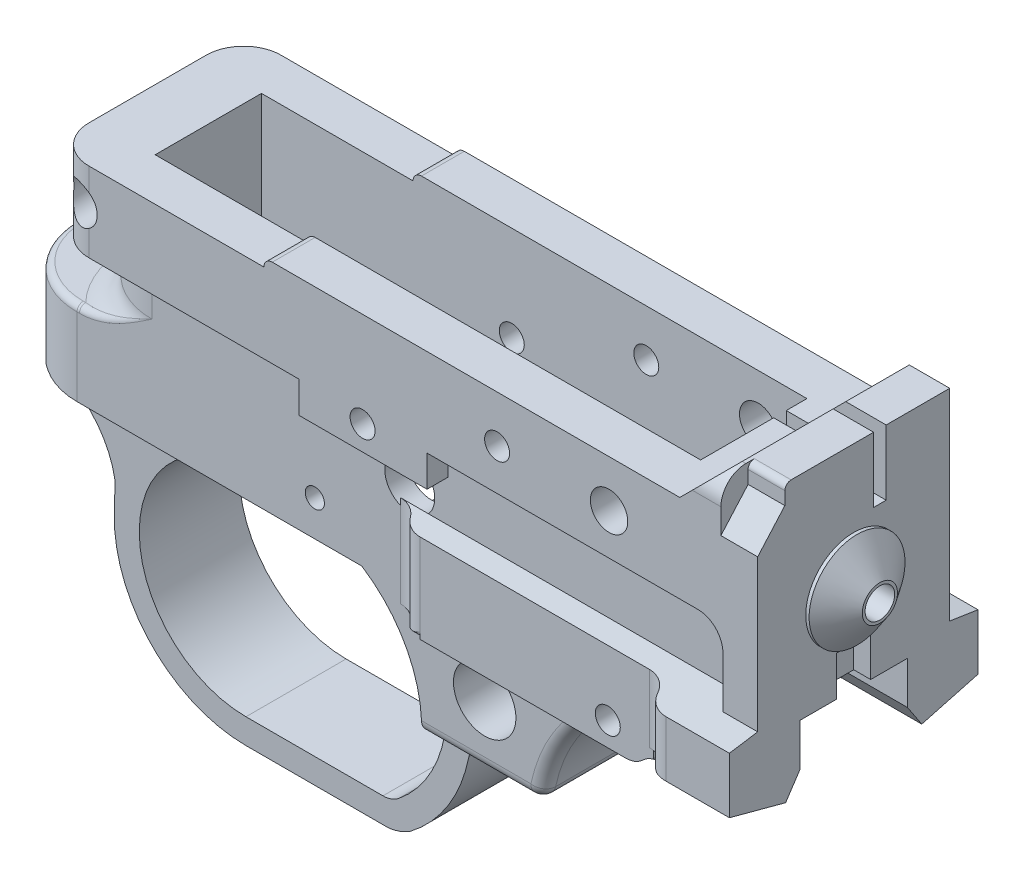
SolidWorks part; units mm, degrees
ref_plane "Front Plane" through (0, 0, 0) normal (0, 0, 1) x (1, 0, 0)
ref_plane "Top Plane" through (0, 0, 0) normal (0, 1, 0) x (1, 0, 0)
ref_plane "Right Plane" through (0, 0, 0) normal (1, 0, 0) x (0, 0, -1)
imported_body "Imported3"
sketch "Sketch1" plane through (0, 18.4153, 0) normal (0, 1, 0) x (-1, 0, 0)
  line L0 (26.5707, -18.3769) -> (26.5707, -21.0439)
  line L1 (26.5707, -21.0439) -> (26.5726, -21.0439)
  line L2 (26.5726, -21.0439) -> (26.5726, -18.3769)
  spline S0 degree 3 poles (26.5726, -18.3769) (26.5719, -18.3769) (26.5713, -18.3769) (26.5707, -18.3769) knots 0 0 0 0 1 1 1 1
extrude "Cut-Extrude1" cut sketch "Sketch1" against normal blind 15.5194
sketch "Sketch2" plane through (0, 0, -21.0439) normal (0, 0, -1) x (-1, 0, 0)
  line L0 (-47.1003, -12.382) -> (-47.1003, -12.6489)
  line L1 (-47.1003, -12.6489) -> (-45.8262, -12.6489)
  arc A0 (-45.8262, -12.6489) -> (-47.1003, -12.382) centre (-45.8262, -9.4739) cw
extrude "Cut-Extrude2" cut sketch "Sketch2" against normal blind 6.1722
sketch "Sketch3" plane through (47.1003, 0, 0) normal (1, 0, 0) x (0, 0, -1)
  line L0 (14.8717, -8.2039) -> (2.8067, -8.2039)
  line L1 (2.8067, -8.2039) -> (2.8067, -12.6489)
  line L2 (2.8067, -12.6489) -> (14.8717, -12.6489)
  line L3 (14.8717, -12.6489) -> (14.8717, -8.2039)
extrude "Cut-Extrude3" cut sketch "Sketch3" against normal blind 1.274
sketch "Sketch4" plane through (-26.5726, 0, 0) normal (-1, 0, 0) x (0, 0, 1)
  line L0 (-18.3769, -10.9471) -> (-18.3769, 2.8959)
  line L1 (-18.3769, 2.8959) -> (-21.0439, 2.8959)
  line L2 (-21.0439, 2.8959) -> (-21.0439, -10.9471)
  line L3 (-21.0439, -10.9471) -> (-18.3769, -10.9471)
extrude "Cut-Extrude4" cut sketch "Sketch4" against normal blind 9.527
sketch "Sketch5" plane through (45.8262, 0, 0) normal (1, 0, 0) x (0, 0, -1)
  line L0 (14.8717, -8.2039) -> (2.8067, -8.2039)
  line L1 (2.8067, -8.2039) -> (2.8067, -12.6489)
  line L2 (2.8067, -12.6489) -> (14.8717, -12.6489)
  line L3 (14.8717, -12.6489) -> (14.8717, -8.2039)
extrude "Cut-Extrude5" cut sketch "Sketch5" against normal blind 5.9505
sketch "Sketch6" plane through (-17.0457, 0, 0) normal (-1, 0, 0) x (0, 0, 1)
  line L0 (-18.3769, -10.9471) -> (-18.3769, 2.8959)
  line L1 (-18.3769, 2.8959) -> (-21.0439, 2.8959)
  line L2 (-21.0439, 2.8959) -> (-21.0439, -10.9471)
  line L3 (-21.0439, -10.9471) -> (-18.3769, -10.9471)
extrude "Cut-Extrude6" cut sketch "Sketch6" against normal blind 21.3487
sketch "Sketch7" plane through (58.1892, 0, 0) normal (1, 0, 0) x (0, 0, -1)
  line L0 (15.6718, -8.2039) -> (2.0066, -8.2039)
  line L1 (2.0066, -8.2039) -> (0.1905, -10.9471)
  line L2 (0.1905, -10.9471) -> (-6.9596, -9.0312)
  line L3 (-6.9596, -9.0312) -> (-6.9596, 19.4821)
  line L4 (-6.9596, 19.4821) -> (21.0439, 19.4821)
  line L5 (21.0439, 19.4821) -> (21.0439, 5.1311)
  line L6 (21.0439, 5.1311) -> (24.638, 5.1311)
  line L7 (24.638, 5.1311) -> (24.638, -9.0312)
  line L8 (24.638, -9.0312) -> (17.4879, -10.9471)
  line L9 (17.4879, -10.9471) -> (15.6718, -8.2039)
extrude "Boss-Extrude1" add sketch "Sketch7" along normal blind 0.7937
sketch "Sketch8" plane through (19.7149, 0, 0) normal (-1, 0, 0) x (0, 0, 1)
  line L0 (3.3655, -12.6489) -> (2.5718, -12.6489)
  line L1 (3.3655, -11.8551) -> (3.3655, -12.6489)
  arc A0 (2.5718, -12.6489) -> (3.3655, -11.8551) centre (2.5718, -11.8551) ccw
extrude "Boss-Extrude2" add sketch "Sketch8" along normal blind 2.1001
sketch "Sketch9" plane through (58.9829, 0, 0) normal (1, 0, 0) x (0, 0, -1)
  line L0 (15.6718, -8.2039) -> (2.0066, -8.2039)
  line L1 (2.0066, -8.2039) -> (0.1905, -10.9471)
  line L2 (0.1905, -10.9471) -> (-6.9596, -9.0312)
  line L3 (-6.9596, -9.0312) -> (-6.9596, 19.4821)
  line L4 (-6.9596, 19.4821) -> (21.0439, 19.4821)
  line L5 (21.0439, 19.4821) -> (21.0439, 5.1311)
  line L6 (21.0439, 5.1311) -> (24.638, 5.1311)
  line L7 (24.638, 5.1311) -> (24.638, -9.0312)
  line L8 (24.638, -9.0312) -> (17.4879, -10.9471)
  line L9 (17.4879, -10.9471) -> (15.6718, -8.2039)
extrude "Boss-Extrude3" add sketch "Sketch9" along normal blind 3.6258
sketch "Sketch10" plane through (17.6148, 0, 0) normal (-1, 0, 0) x (0, 0, 1)
  line L0 (2.5718, -12.6489) -> (3.3655, -12.6489)
  line L1 (3.3655, -12.6489) -> (3.3655, -11.8551)
  arc A0 (3.3655, -11.8551) -> (2.5718, -12.6489) centre (2.5718, -11.8551) cw
extrude "Cut-Extrude7" cut sketch "Sketch10" against normal blind 2.1001
sketch "Sketch11" plane through (49.5938, 0, 0) normal (1, 0, 0) x (0, 0, -1)
  line L0 (-3.3655, -9.9942) -> (-3.3655, -10.9471)
  line L1 (-3.3655, -10.9471) -> (0.1905, -10.9471)
  line L2 (0.1905, -10.9471) -> (-3.3655, -9.9942)
extrude "Cut-Extrude8" cut sketch "Sketch11" against normal blind 0.2058
sketch "Sketch12" plane through (0, 2.8959, 0) normal (0, -1, 0) x (1, 0, 0)
  line L0 (19.7149, 3.3655) -> (-26.5707, 3.3655)
  line L1 (-26.5707, 3.3655) -> (-26.5707, -8.8265)
  line L2 (-17.0457, 0.6985) -> (4.303, 0.6985)
  arc A0 (14.5421, 0.6985) -> (17.1285, 2.032) centre (14.5421, 3.8735) ccw
  arc A1 (17.1285, 2.032) -> (19.7149, 3.3655) centre (19.7149, 0.1905) cw
  arc A2 (-26.5707, -8.8265) -> (-17.0457, 0.6985) centre (-17.0457, -8.8265) cw
  spline S0 degree 1 poles (4.303, 0.6985) (14.5421, 0.6985) knots -2.347258 -2.347258 -0.242243 -0.242243
extrude "Cut-Extrude9" cut sketch "Sketch12" against normal blind 1.4224
sketch "Sketch13" plane through (0, -8.2039, 0) normal (0, -1, 0) x (1, 0, 0)
  line L0 (51.4953, -15.6718) -> (62.6087, -15.6718)
  line L1 (62.6087, -15.6718) -> (62.6087, -2.0066)
  line L2 (62.6087, -2.0066) -> (51.4953, -2.0066)
  line L3 (49.388, -2.8067) -> (39.8757, -2.8067)
  line L4 (39.8757, -2.8067) -> (39.8757, -14.8717)
  line L5 (39.8757, -14.8717) -> (49.388, -14.8717)
  arc A0 (51.4953, -2.0066) -> (50.4417, -2.4066) centre (51.4953, -3.5941) ccw
  arc A1 (50.4417, -2.4066) -> (49.388, -2.8067) centre (49.388, -1.2192) cw
  arc A2 (49.388, -14.8717) -> (50.4417, -15.2718) centre (49.388, -16.4592) cw
  arc A3 (50.4417, -15.2718) -> (51.4953, -15.6718) centre (51.4953, -14.0843) ccw
extrude "Cut-Extrude10" cut sketch "Sketch13" against normal blind 0.6043
sketch "Sketch14" plane through (0, 4.3183, 0) normal (0, -1, 0) x (1, 0, 0)
  line L0 (4.303, 3.3655) -> (-26.5707, 3.3655)
  line L1 (-26.5707, 3.3655) -> (-26.5707, -8.8265)
  line L2 (-17.0457, 0.6985) -> (4.303, 0.6985)
  line L3 (4.303, 0.6985) -> (4.303, 3.3655)
  arc A0 (-26.5707, -8.8265) -> (-17.0457, 0.6985) centre (-17.0457, -8.8265) cw
extrude "Cut-Extrude11" cut sketch "Sketch14" against normal blind 3.9878
sketch "Sketch15" plane through (0, -7.5996, 0) normal (0, -1, 0) x (1, 0, 0)
  line L0 (51.4953, -15.6718) -> (62.6087, -15.6718)
  line L1 (62.6087, -15.6718) -> (62.6087, -2.0066)
  line L2 (62.6087, -2.0066) -> (51.4953, -2.0066)
  line L3 (49.388, -2.8067) -> (39.8757, -2.8067)
  line L4 (39.8757, -2.8067) -> (39.8757, -14.8717)
  line L5 (39.8757, -14.8717) -> (49.388, -14.8717)
  arc A0 (51.4953, -2.0066) -> (50.4417, -2.4066) centre (51.4953, -3.5941) ccw
  arc A1 (50.4417, -2.4066) -> (49.388, -2.8067) centre (49.388, -1.2192) cw
  arc A2 (49.388, -14.8717) -> (50.4417, -15.2718) centre (49.388, -16.4592) cw
  arc A3 (50.4417, -15.2718) -> (51.4953, -15.6718) centre (51.4953, -14.0843) ccw
extrude "Cut-Extrude12" cut sketch "Sketch15" against normal blind 4.8059
sketch "Sketch16" plane through (0, 5.1311, 0) normal (0, 1, 0) x (-1, 0, 0)
  line L0 (-58.1892, -24.638) -> (-58.1892, -20.2579)
  line L1 (-58.9829, -21.0439) -> (-62.6087, -21.0439)
  line L2 (-62.6087, -21.0439) -> (-62.6087, -24.638)
  line L3 (-62.6087, -24.638) -> (-58.1892, -24.638)
  arc A0 (-58.1892, -20.2579) -> (-58.9829, -21.0439) centre (-58.9829, -20.2502) cw
extrude "Cut-Extrude13" cut sketch "Sketch16" against normal blind 6.5024
sketch "Sketch17" plane through (0, 19.4821, 0) normal (0, 1, 0) x (-1, 0, 0)
  line L0 (-62.6087, 6.9596) -> (-62.6087, 3.3655)
  line L1 (-62.6087, 3.3655) -> (-48.8362, 3.3655)
  line L2 (-54.5569, 6.9596) -> (-62.6087, 6.9596)
  arc A0 (-48.8362, 3.3655) -> (-51.6966, 5.1625) centre (-48.8362, 6.5405) cw
  arc A1 (-51.6966, 5.1625) -> (-54.5569, 6.9596) centre (-54.5569, 3.7846) ccw
extrude "Cut-Extrude14" cut sketch "Sketch17" against normal blind 15.1638
sketch "Sketch18" plane through (0, 4.3183, 0) normal (0, 1, 0) x (-1, 0, 0)
  line L0 (-62.6087, 6.9596) -> (-62.6087, 3.3655)
  line L1 (-62.6087, 3.3655) -> (-58.1891, 3.3655)
  line L2 (-58.1891, 3.3655) -> (-58.1891, 0.6985)
  line L3 (-58.1891, 0.6985) -> (-14.5421, 0.6985)
  line L4 (-19.7149, 3.3655) -> (-48.8362, 3.3655)
  line L5 (-54.5569, 6.9596) -> (-62.6087, 6.9596)
  arc A0 (-14.5421, 0.6985) -> (-17.1285, 2.032) centre (-14.5421, 3.8735) cw
  arc A1 (-17.1285, 2.032) -> (-19.7149, 3.3655) centre (-19.7149, 0.1905) ccw
  arc A2 (-48.8362, 3.3655) -> (-51.6966, 5.1625) centre (-48.8362, 6.5405) cw
  arc A3 (-51.6966, 5.1625) -> (-54.5569, 6.9596) centre (-54.5569, 3.7846) ccw
extrude "Cut-Extrude15" cut sketch "Sketch18" against normal blind 6.249
sketch "Sketch20" plane through (0, 2.8959, 0) normal (0, -1, 0) x (1, 0, 0)
  line L0 (-26.5707, -8.8519) -> (-26.5707, -21.0439)
  line L1 (-26.5707, -21.0439) -> (4.303, -21.0439)
  line L2 (4.303, -21.0439) -> (4.303, -18.3769)
  line L3 (4.303, -18.3769) -> (-17.0457, -18.3769)
  arc A0 (-17.0457, -18.3769) -> (-26.5707, -8.8519) centre (-17.0457, -8.8519) cw
extrude "Cut-Extrude17" cut sketch "Sketch20" against normal blind 5.4102
sketch "Sketch21" plane through (0, 0, -20.2502) normal (0, 0, -1) x (-1, 0, 0)
  line L0 (-55.0141, -6.5529) -> (-20.5844, -6.5529)
  line L1 (-20.5844, -6.5529) -> (-20.5844, 8.3061)
  line L2 (-20.5844, 8.3061) -> (-55.0141, 8.3061)
  line L3 (-58.1891, 5.1311) -> (-58.1891, -3.0848)
  line L4 (-58.1891, -3.0848) -> (-58.1756, -3.0848)
  arc A0 (-55.0141, 8.3061) -> (-58.1891, 5.1311) centre (-55.0141, 5.1311) ccw
  arc A1 (-58.1756, -3.0848) -> (-55.0141, -6.5529) centre (-55.0141, -3.3779) ccw
extrude "Cut-Extrude18" cut sketch "Sketch21" against normal blind 1.8732
sketch "Sketch22" plane through (0, -2.7937, 0) normal (0, -1, 0) x (1, 0, 0)
  line L0 (39.8757, -14.8717) -> (49.388, -14.8717)
  line L1 (49.9087, -14.9595) -> (49.9087, -2.7189)
  line L2 (49.388, -2.8067) -> (39.8757, -2.8067)
  line L3 (39.8757, -2.8067) -> (39.8757, -14.8717)
  arc A0 (49.388, -14.8717) -> (49.9087, -14.9595) centre (49.388, -16.4592) cw
  arc A1 (49.9087, -2.7189) -> (49.388, -2.8067) centre (49.388, -1.2192) cw
extrude "Cut-Extrude19" cut sketch "Sketch22" against normal blind 21.209
ref_plane "Plane4" through (0, 0, -14.9595) normal (0, 0, -1) x (-1, 0, 0)
sketch "Sketch23" plane through (0, 0, -14.9595) normal (0, 0, -1) x (-1, 0, 0)
  line L0 (-49.9087, 19.4821) -> (-49.9087, 18.4153)
  line L1 (-49.9087, 18.4153) -> (0.1547, 18.4153)
  line L2 (-0.9121, 19.4821) -> (-49.9087, 19.4821)
  arc A0 (0.1547, 18.4153) -> (-0.9121, 19.4821) centre (-0.9121, 18.4153) ccw
extrude "Cut-Extrude20" cut sketch "Sketch23" against normal blind 12.2406
sketch "Sketch24" plane through (0, -10.9471, 0) normal (0, -1, 0) x (1, 0, 0)
  line L0 (15.6374, -18.3769) -> (4.303, -18.3769)
  line L1 (4.303, -18.3769) -> (4.303, -21.0439)
  line L2 (4.303, -21.0439) -> (20.5844, -21.0439)
  line L3 (20.5844, -21.0439) -> (20.5844, -21.0359)
  arc A0 (18.2238, -19.7104) -> (15.6374, -18.3769) centre (15.6374, -21.5519) ccw
  arc A1 (20.5844, -21.0359) -> (18.2238, -19.7104) centre (20.8102, -17.8689) cw
extrude "Cut-Extrude21" cut sketch "Sketch24" against normal blind 3.6118
sketch "Sketch25" plane through (0, -7.3353, 0) normal (0, -1, 0) x (1, 0, 0)
  line L0 (15.6374, -18.3769) -> (4.303, -18.3769)
  line L1 (4.303, -18.3769) -> (4.303, -21.0439)
  line L2 (4.303, -21.0439) -> (20.5844, -21.0439)
  line L3 (20.5844, -21.0439) -> (20.5844, -21.0359)
  arc A0 (18.2238, -19.7104) -> (15.6374, -18.3769) centre (15.6374, -21.5519) ccw
  arc A1 (20.5844, -21.0359) -> (18.2238, -19.7104) centre (20.8102, -17.8689) cw
extrude "Cut-Extrude22" cut sketch "Sketch25" against normal blind 0.7824
sketch "Sketch26" plane through (0, -6.5529, 0) normal (0, -1, 0) x (1, 0, 0)
  line L0 (4.303, -21.0439) -> (20.5844, -21.0439)
  line L1 (20.5844, -21.0439) -> (20.5844, -18.3769)
  line L2 (20.5844, -18.3769) -> (4.303, -18.3769)
  line L3 (4.303, -18.3769) -> (4.303, -21.0439)
extrude "Cut-Extrude23" cut sketch "Sketch26" against normal blind 10.8712
sketch "Sketch27" plane through (0, 0, -2.7189) normal (0, 0, -1) x (-1, 0, 0)
  line L0 (-49.9087, 19.4821) -> (-49.9087, 18.4153)
  line L1 (-49.9087, 18.4153) -> (0.1547, 18.4153)
  line L2 (-0.9121, 19.4821) -> (-49.9087, 19.4821)
  arc A0 (0.1547, 18.4153) -> (-0.9121, 19.4821) centre (-0.9121, 18.4153) ccw
extrude "Cut-Extrude24" cut sketch "Sketch27" against normal blind 0.6361
sketch "Sketch28" plane through (0, 0, -14.9595) normal (0, 0, 1) x (1, 0, 0)
  line L0 (-0.1547, 18.4153) -> (49.9087, 18.4153)
  line L1 (49.9087, 18.4153) -> (49.9087, 19.4821)
  line L2 (49.9087, 19.4821) -> (0.9121, 19.4821)
  arc A0 (0.9121, 19.4821) -> (-0.1547, 18.4153) centre (0.9121, 18.4153) ccw
extrude "Cut-Extrude25" cut sketch "Sketch28" against normal blind 0.6361
sketch "Sketch29" plane through (0, 18.4153, 0) normal (0, 1, 0) x (-1, 0, 0)
  line L0 (-49.9087, -14.9595) -> (-49.9087, -15.5956)
  line L1 (-49.9087, -15.5956) -> (19.4206, -15.5956)
  line L2 (19.4206, -15.5956) -> (19.4206, -2.0828)
  line L3 (19.4206, -2.0828) -> (-49.9087, -2.0828)
  line L4 (-49.9087, -2.0828) -> (-49.9087, -2.7189)
  line L5 (-49.388, -2.8067) -> (-39.8757, -2.8067)
  line L6 (-39.8757, -2.8067) -> (-39.8757, -14.8717)
  line L7 (-39.8757, -14.8717) -> (-49.388, -14.8717)
  arc A0 (-49.9087, -2.7189) -> (-49.388, -2.8067) centre (-49.388, -1.2192) ccw
  arc A1 (-49.388, -14.8717) -> (-49.9087, -14.9595) centre (-49.388, -16.4592) ccw
extrude "Cut-Extrude26" cut sketch "Sketch29" against normal blind 21.209
sketch "Sketch30" plane through (0, -2.7937, 0) normal (0, 1, 0) x (-1, 0, 0)
  line L0 (-49.9087, -14.9595) -> (-49.9087, -15.5956)
  line L1 (-49.9087, -15.5956) -> (19.4206, -15.5956)
  line L2 (19.4206, -15.5956) -> (19.4206, -2.0828)
  line L3 (19.4206, -2.0828) -> (-49.9087, -2.0828)
  line L4 (-49.9087, -2.0828) -> (-49.9087, -2.7189)
  line L5 (-49.388, -2.8067) -> (-39.8757, -2.8067)
  line L6 (-39.8757, -2.8067) -> (-39.8757, -14.8717)
  line L7 (-39.8757, -14.8717) -> (-49.388, -14.8717)
  arc A0 (-49.9087, -2.7189) -> (-49.388, -2.8067) centre (-49.388, -1.2192) ccw
  arc A1 (-49.388, -14.8717) -> (-49.9087, -14.9595) centre (-49.388, -16.4592) ccw
extrude "Cut-Extrude27" cut sketch "Sketch30" against normal blind 6.2992
sketch "Sketch31" plane through (-26.5707, 0, 0) normal (-1, 0, 0) x (0, 0, 1)
  line L0 (-21.0439, 18.4153) -> (3.3655, 18.4153)
  line L1 (3.3655, 18.4153) -> (3.3655, 8.3061)
  line L2 (3.3655, 8.3061) -> (-21.0439, 8.3061)
  line L3 (-21.0439, 8.3061) -> (-21.0439, 18.4153)
extrude "Boss-Extrude4" add sketch "Sketch31" along normal blind 0.5715
sketch "Sketch32" plane through (62.6087, 0, 0) normal (1, 0, 0) x (0, 0, -1)
  line L0 (12.9667, 19.4821) -> (11.3665, 19.4821)
  line L1 (11.3665, 19.4821) -> (11.3665, 15.9642)
  line L2 (11.3665, 15.9642) -> (12.9667, 15.9642)
  line L3 (12.9667, 15.9642) -> (12.9667, 19.4821)
extrude "Cut-Extrude28" cut sketch "Sketch32" against normal up to next
sketch "Sketch33" plane through (0, 19.4821, 0) normal (0, 1, 0) x (-1, 0, 0)
  line L0 (-62.6087, 3.3655) -> (-57.4702, 3.3655)
  line L1 (-57.4702, 3.3655) -> (-57.4702, -11.3665)
  line L2 (-57.4702, -11.3665) -> (-62.6087, -11.3665)
  line L3 (-62.6087, -11.3665) -> (-62.6087, 3.3655)
extrude "Boss-Extrude5" add sketch "Sketch33" along normal blind 4.7625
sketch "Sketch34" plane through (0, 19.4821, 0) normal (0, 1, 0) x (-1, 0, 0)
  line L0 (-57.4702, -21.0439) -> (-62.6087, -21.0439)
  line L1 (-62.6087, -21.0439) -> (-62.6087, -12.9667)
  line L2 (-62.6087, -12.9667) -> (-57.4702, -12.9667)
  line L3 (-57.4702, -12.9667) -> (-57.4702, -21.0439)
extrude "Boss-Extrude6" add sketch "Sketch34" along normal blind 4.7625
ref_plane "Plane5" through (0, 8.3061, 0) normal (0, 1, 0) x (1, 0, 0)
sketch "Sketch35" plane through (0, 8.3061, 0) normal (0, 1, 0) x (1, 0, 0)
  line L0 (20.5844, -0.6985) -> (20.5844, -3.3655)
  line L1 (20.5844, -3.3655) -> (58.1891, -3.3655)
  line L2 (58.1891, -3.3655) -> (58.1891, -0.6985)
  line L3 (58.1891, -0.6985) -> (20.5844, -0.6985)
extrude "Cut-Extrude29" cut sketch "Sketch35" against normal up to next
sketch "Sketch36" plane through (0, -12.6489, 0) normal (0, -1, 0) x (1, 0, 0)
  line L0 (39.8757, -14.8717) -> (39.8757, -2.8067)
  line L1 (39.8757, -2.8067) -> (39.4693, -2.8067)
  line L2 (39.4693, -2.8067) -> (39.4693, -14.8717)
  line L3 (39.4693, -14.8717) -> (39.8757, -14.8717)
extrude "Cut-Extrude30" cut sketch "Sketch36" against normal blind 1.7018
sketch "Sketch37" plane through (0, -9.0929, 0) normal (0, 1, 0) x (-1, 0, 0)
  line L0 (-8.7334, -4.0894) -> (-8.7334, -13.6144)
  line L1 (-8.7334, -13.6144) -> (14.406, -13.6144)
  line L2 (14.406, -13.6144) -> (14.406, -4.0894)
  line L3 (14.406, -4.0894) -> (-8.7334, -4.0894)
extrude "Cut-Extrude31" cut sketch "Sketch37" against normal up to next
sketch "Sketch38" plane through (0, 0, 3.3655) normal (0, 0, 1) x (1, 0, 0)
  line L0 (57.9351, 21.8062) -> (62.6087, 21.8062)
  line L1 (62.6087, 21.8062) -> (62.6087, 24.2446)
  line L2 (62.6087, 24.2446) -> (57.9351, 24.2446)
  line L3 (57.9351, 24.2446) -> (57.9351, 21.8062)
extrude "Cut-Extrude32" cut sketch "Sketch38" against normal blind 3.4544
sketch "Sketch39" plane through (62.6087, 0, 0) normal (1, 0, 0) x (0, 0, -1)
  line L0 (10.9982, -2.7937) -> (10.9982, 2.2863)
  line L1 (10.9982, 2.2863) -> (6.6802, 2.2863)
  line L2 (6.6802, 2.2863) -> (6.6802, -2.7937)
  line L3 (6.6802, -2.7937) -> (10.9982, -2.7937)
extrude "Cut-Extrude33" cut sketch "Sketch39" against normal blind 2.159
draft "Draft1" type of draft neutral plane draft angle 8.847 faces to draft 1 parameters "D1"=8.847
draft "Draft2" type of draft neutral plane draft angle 48.552 faces to draft 1 parameters "D1"=48.552
draft "Draft3" type of draft neutral plane draft angle 45 faces to draft 1 parameters "D1"=45
draft "Draft4" type of draft neutral plane draft angle 45 faces to draft 1 parameters "D1"=45
draft "Draft5" type of draft neutral plane draft angle 8.847 faces to draft 1 parameters "D1"=8.847
ref_plane "Plane6" through (0, 0, -8.8392) normal (0, 0, 1) x (1, 0, 0)
sketch "Sketch40" plane through (0, 0, -8.8392) normal (0, 0, 1) x (1, 0, 0)
  line L0 (62.6087, 14.4783) -> (62.6087, 8.3823)
  line L1 (62.6087, 8.3823) -> (65.9361, 8.3823)
  line L2 (65.9361, 8.3823) -> (65.9361, 10.6189)
  line L3 (65.9361, 10.6189) -> (63.0377, 14.4783)
  line L4 (63.0377, 14.4783) -> (62.6087, 14.4783)
  line L5 (62.6075, 8.3823) -> (65.9361, 8.3823) construction
revolve "Revolve1" add sketch "Sketch40" angle 360 about L5
hole_wizard "Hole1" positions "Sketch42" profile "Sketch41" legacy
sketch "Sketch42" plane through (0, 0, -21.0439) normal (0, 0, -1) x (-1, 0, 0)
  point P0 (-43.5587, -9.6263)
sketch "Sketch41" plane through (43.5587, -9.6263, -21.0439) normal (1, 0, 0) x (0, 1, 0)
  line L0 (0, 0) -> (0, 6.1722)
  line L1 (0, 6.1722) -> (1.5875, 6.1722)
  line L2 (1.5875, 6.1722) -> (1.5875, 0)
  line L3 (1.5875, 0) -> (0, 0)
  line L4 (0, 110) -> (0, -10) construction
  dimension "Diameter" = 3.175
  dimension "Depth" = 6.1722
hole_wizard "M2 Clearance Hole1" positions "Sketch44" profile "Sketch43" hole size "M2" standard "ANSI Metric"
sketch "Sketch44" plane through (0, 0, -15.5956) normal (0, 0, 1) x (1, 0, 0)
  point P0 (3.6553, -6.4259)
sketch "Sketch43" plane through (3.6553, -6.4259, -15.5956) normal (1, 0, 0) x (0, -1, 0)
  line L0 (0, 0) -> (0, 9.0424)
  line L1 (0, 9.0424) -> (1.2192, 9.0424)
  line L2 (1.2192, 9.0424) -> (1.2192, 0)
  line L5 (1.2192, 0) -> (0, 0)
  line L11 (0, -6.35) -> (0, 107.95) construction
  dimension "Thru Hole Dia." = 2.4384
  dimension "Thru Hole Depth" = 9.0424
hole_wizard "Hole2" positions "Sketch46" profile "Sketch45" legacy
sketch "Sketch46" plane through (0, 0, 3.3655) normal (0, 0, 1) x (1, 0, 0)
  point P0 (43.5587, -9.6263)
sketch "Sketch45" plane through (43.5587, -9.6263, 3.3655) normal (1, 0, 0) x (0, -1, 0)
  line L0 (0, 0) -> (0, 28.0035)
  line L1 (0, 28.0035) -> (1.5875, 28.0035)
  line L2 (1.5875, 28.0035) -> (1.5875, 0)
  line L3 (1.5875, 0) -> (0, 0)
  line L4 (0, 110) -> (0, -10) construction
  dimension "Diameter" = 3.175
  dimension "Depth" = 28.0035
hole_wizard "Hole3" positions "Sketch48" profile "Sketch47" legacy
sketch "Sketch48" plane through (0, 0, -21.0439) normal (0, 0, -1) x (-1, 0, 0)
  point P0 (-29.4871, 13.5131)
  point P1 (-12.3929, 7.4171)
sketch "Sketch47" plane through (29.4871, 13.5131, -21.0439) normal (1, 0, 0) x (0, 1, 0)
  line L0 (0, 0) -> (0, 5.4483)
  line L1 (0, 5.4483) -> (1.5875, 5.4483)
  line L2 (1.5875, 5.4483) -> (1.5875, 0)
  line L3 (1.5875, 0) -> (0, 0)
  line L4 (0, 110) -> (0, -10) construction
  dimension "Diameter" = 3.175
  dimension "Depth" = 5.4483
hole_wizard "M4 Clearance Hole1" positions "Sketch50" profile "Sketch49" hole size "M4" standard "ANSI Metric"
sketch "Sketch50" plane through (0, 0, -21.0439) normal (0, 0, -1) x (-1, 0, 0)
  point P0 (-43.7175, 13.5131)
sketch "Sketch49" plane through (43.7175, 13.5131, -21.0439) normal (1, 0, 0) x (0, 1, 0)
  line L0 (0, 0) -> (0, 5.4483)
  line L1 (0, 5.4483) -> (2.3813, 5.4483)
  line L2 (2.3813, 5.4483) -> (2.3812, 0)
  line L5 (2.3812, 0) -> (0, 0)
  line L11 (0, -6.35) -> (0, 107.95) construction
  dimension "Thru Hole Dia." = 4.7625
  dimension "Thru Hole Depth" = 5.4483
hole_wizard "M7 Clearance Hole1" positions "Sketch52" profile "Sketch51" hole size "M7" standard "ANSI Metric"
sketch "Sketch52" plane through (0, 0, -18.3769) normal (0, 0, -1) x (-1, 0, 0)
  point P0 (-25.2453, -17.8813)
sketch "Sketch51" plane through (25.2453, -17.8813, -18.3769) normal (1, 0, 0) x (0, 1, 0)
  line L0 (0, 0) -> (0, 25.3365)
  line L1 (0, 25.3365) -> (3.9687, 25.3365)
  line L2 (3.9687, 25.3365) -> (3.9687, 0)
  line L5 (3.9687, 0) -> (0, 0)
  line L11 (0, -6.35) -> (0, 107.95) construction
  dimension "Thru Hole Dia." = 7.9375
  dimension "Thru Hole Depth" = 25.3365
hole_wizard "M2 Clearance Hole2" positions "Sketch54" profile "Sketch53" hole size "M2" standard "ANSI Metric"
sketch "Sketch54" plane through (0, 0, 0.6985) normal (0, 0, 1) x (1, 0, 0)
  point P0 (3.6553, -6.4259)
sketch "Sketch53" plane through (3.6553, -6.4259, 0.6985) normal (1, 0, 0) x (0, -1, 0)
  line L0 (0, 0) -> (0, 25.3365)
  line L1 (0, 25.3365) -> (1.2192, 25.3365)
  line L2 (1.2192, 25.3365) -> (1.2192, 0)
  line L5 (1.2192, 0) -> (0, 0)
  line L11 (0, -6.35) -> (0, 107.95) construction
  dimension "Thru Hole Dia." = 2.4384
  dimension "Thru Hole Depth" = 25.3365
hole_wizard "M4 Clearance Hole2" positions "Sketch56" profile "Sketch55" hole size "M4" standard "ANSI Metric"
sketch "Sketch56" plane through (0, 0, 3.3655) normal (0, 0, 1) x (1, 0, 0)
  point P0 (-23.7195, 13.5131)
sketch "Sketch55" plane through (-23.7195, 13.5131, 3.3655) normal (1, 0, 0) x (0, -1, 0)
  line L0 (0, 0) -> (0, 28.0035)
  line L1 (0, 28.0035) -> (2.3812, 28.0035)
  line L2 (2.3812, 28.0035) -> (2.3812, 0)
  line L5 (2.3812, 0) -> (0, 0)
  line L11 (0, -6.35) -> (0, 107.95) construction
  dimension "Thru Hole Dia." = 4.7625
  dimension "Thru Hole Depth" = 28.0035
hole_wizard "Hole4" positions "Sketch58" profile "Sketch57" legacy
sketch "Sketch58" plane through (0, 0, -2.0828) normal (0, 0, -1) x (-1, 0, 0)
  point P0 (-29.4871, 13.5131)
  point P1 (-12.3929, 7.4171)
sketch "Sketch57" plane through (29.4871, 13.5131, -2.0828) normal (1, 0, 0) x (0, 1, 0)
  line L0 (0, 0) -> (0, 9.0424)
  line L1 (0, 9.0424) -> (1.5875, 9.0424)
  line L2 (1.5875, 9.0424) -> (1.5875, 0)
  line L3 (1.5875, 0) -> (0, 0)
  line L4 (0, 110) -> (0, -10) construction
  dimension "Diameter" = 3.175
  dimension "Depth" = 9.0424
hole_wizard "M4 Clearance Hole3" positions "Sketch60" profile "Sketch59" hole size "M4" standard "ANSI Metric"
sketch "Sketch60" plane through (0, 0, -2.0828) normal (0, 0, -1) x (-1, 0, 0)
  point P0 (-43.7175, 13.5131)
sketch "Sketch59" plane through (43.7175, 13.5131, -2.0828) normal (1, 0, 0) x (0, 1, 0)
  line L0 (0, 0) -> (0, 9.0424)
  line L1 (0, 9.0424) -> (2.3812, 9.0424)
  line L2 (2.3812, 9.0424) -> (2.3812, 0)
  line L5 (2.3812, 0) -> (0, 0)
  line L11 (0, -6.35) -> (0, 107.95) construction
  dimension "Thru Hole Dia." = 4.7625
  dimension "Thru Hole Depth" = 9.0424
hole_wizard "Hole5" positions "Sketch62" profile "Sketch61" legacy
sketch "Sketch62" plane through (0, 0, 0.6985) normal (0, 0, 1) x (1, 0, 0)
  point P0 (15.7203, 1.1433)
sketch "Sketch61" plane through (15.7203, 1.1433, 0.6985) normal (1, 0, 0) x (0, -1, 0)
  line L0 (0, 0) -> (0, 2.7813)
  line L1 (0, 2.7813) -> (3.175, 2.7813)
  line L2 (3.175, 2.7813) -> (3.175, 0)
  line L3 (3.175, 0) -> (0, 0)
  line L4 (0, 110) -> (0, -10) construction
  dimension "Diameter" = 6.35
  dimension "Depth" = 2.7813
hole_wizard "M3.5 Clearance Hole1" positions "Sketch64" profile "Sketch63" hole size "M3.5" standard "ANSI Metric"
sketch "Sketch64" plane through (65.9361, 0, 0) normal (1, 0, 0) x (0, 0, -1)
  point P0 (8.8392, 8.3823)
sketch "Sketch63" plane through (65.9361, 8.3823, -8.8392) normal (0, 1, 0) x (0, 0, -1)
  line L0 (0, 0) -> (0, 3.3274)
  line L1 (0, 3.3274) -> (1.8796, 3.3274)
  line L2 (1.8796, 3.3274) -> (1.8796, 0)
  line L5 (1.8796, 0) -> (0, 0)
  line L10 (0, 3.3274) -> (-1.8796, 3.3274) construction
  line L11 (0, -6.35) -> (0, 107.95) construction
  dimension "Hole Dia." = 3.7592
  dimension "Hole Depth" = 3.3274
  dimension "Drill Angle" = 180
fillet "Fillet1" radius 1.5875 18 edges at (50.9717, -9.2254, -1.3303) (39.4693, -12.6489, -1.0541) (39.4693, -12.8775, -18.3769) (39.4693, -12.8775, 0.6985) (-20.9722, -10.9471, -15.2019) (-33.6721, -11.0782, -2.4765) (32.5009, -25.4067, 0.1036) (32.4462, -25.7553, -8.8392) (33.0381, -23.0411, -15.671) (35.2136, -18.0936, -18.3769) (39.4693, -13.1061, -8.8392) (35.2136, -18.0936, 0.6985) (-33.6721, -11.0782, -15.2019) (-20.9722, -10.9471, -2.4765) (50.9318, -8.0477, -2.11) (39.4693, -12.6489, -16.6243)
fillet "Fillet3" radius 0.7938 1 edges at (60.2719, 24.2446, -0.0889)
fillet "Fillet4" radius 3.175 12 edges at (20.0276, -28.4649, 0.2339) (49.0134, -10.9471, -14.8717) (48.6387, -10.9471, -17.9578) (47.1003, -12.6489, 0.2794) (10.1978, -38.0697, -8.8392) (20.0276, -28.4649, -17.9123) (20.3888, -25.7553, -8.8392) (57.7027, 24.2446, 3.3655) (58.1891, 8.3061, 2.032)
fillet "Fillet5" radius 4.7625 2 edges at (-27.1422, 13.3607, 3.3655) (-27.1422, 13.3607, -21.0439)
fillet "Fillet6" radius 16.7363 1 edges at (-25.4209, -41.2447, -8.8392)
